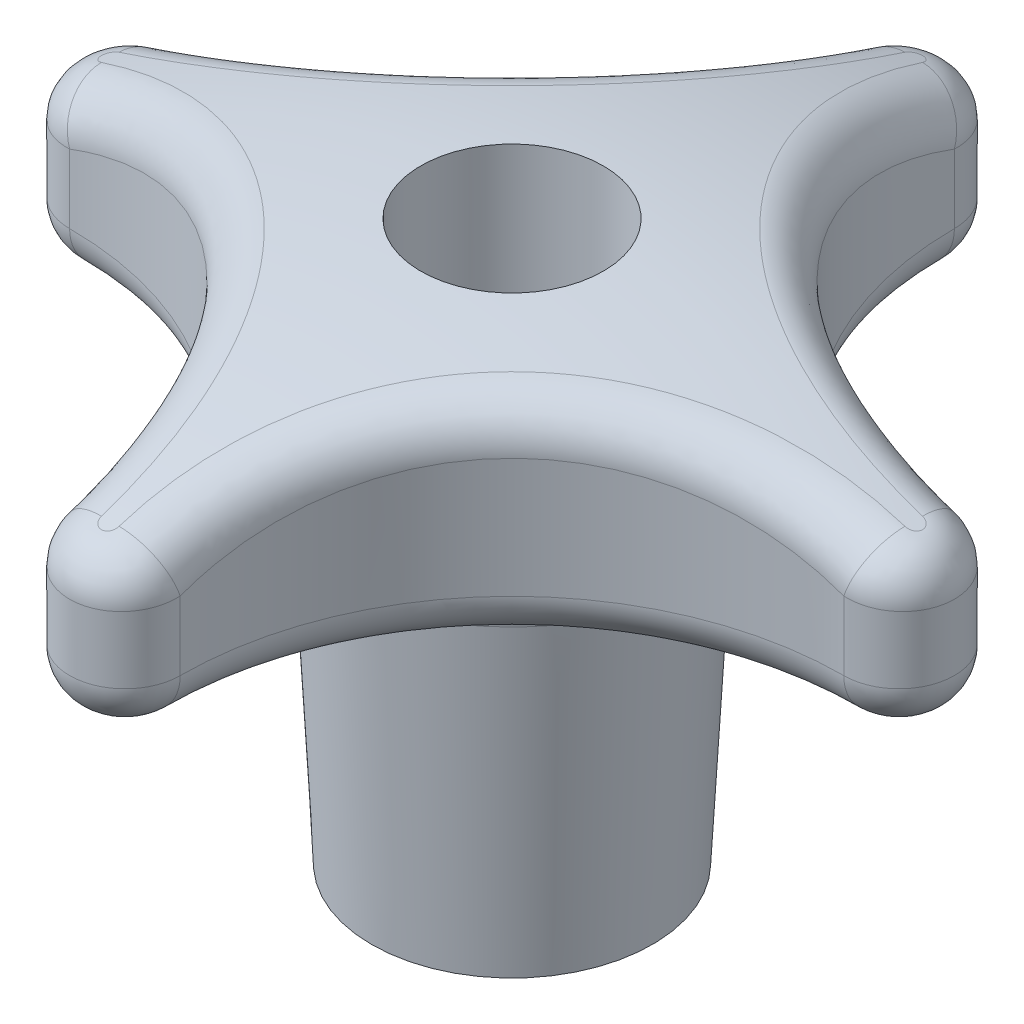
SolidWorks part; units mm, degrees
ref_plane "Front Plane" through (0, 0, 0) normal (0, 0, 1) x (1, 0, 0)
ref_plane "Top Plane" through (0, 0, 0) normal (0, 1, 0) x (1, 0, 0)
ref_plane "Right Plane" through (0, 0, 0) normal (1, 0, 0) x (0, 0, -1)
sketch "Sketch1" plane through (0, 0, 0) normal (0, 1, 0) x (1, 0, 0)
  circle A0 centre (0, 0) radius 10
  dimension "D1" = 20
extrude "Extrude1" add sketch "Sketch1" against normal blind 24
draft "Draft1" type of draft neutral plane draft angle 3 faces to draft 1 parameters "D1"=3
sketch "Sketch2" plane through (0, 0, 0) normal (0, 0, 1) x (1, 0, 0)
  line L0 (0, 0) -> (-31.5, 0)
  line L1 (-31.5, 0) -> (-31.5, 10.4)
  line L2 (0, 0) -> (0, 50000) construction
  line L3 (0, 16) -> (20.2547, 16) construction
  line L4 (0, 0) -> (0, 16)
  arc A0 (0, 16) -> (-31.5, 10.4) centre (0, -75.3937) ccw
revolve "Revolve1" add sketch "Sketch2" angle 360 about L2
sketch "Sketch4" plane through (0, 0, 0) normal (0, 1, 0) x (1, 0, 0)
  line L0 (0, 0) -> (-50000, 0) construction
  line L1 (0, 0) -> (0, 50000) construction
  line L2 (-27.5625, 3.9375) -> (-45.9117, 3.9375) construction
  line L3 (-3.9375, 27.5625) -> (-3.9375, 40.3224) construction
  arc A0 (0, 31.5) -> (-3.9375, 27.5625) centre (0, 27.5625) ccw
  arc A1 (-27.5625, 3.9375) -> (-31.5, 0) centre (-27.5625, 0) ccw
  circle A2 centre (0, 0) radius 31.5 construction
  arc A3 (-27.5625, 3.9375) -> (-3.9375, 27.5625) centre (-27.5625, 27.5625) ccw
  arc A4 (0, 31.5) -> (-31.5, 0) centre (-31.5, 31.5) ccw
  point P9 (0, 31.5)
  point P10 (-31.5, 0)
  point P13 (-3.9375, 27.5625)
  point P14 (-27.5625, 3.9375)
extrude "Extrude3" cut sketch "Sketch4" along normal through all
pattern_circular "CirPattern1" count 4 over 360 about axis through (0, 0, 0) along (0, 1, 0) of "Extrude3"
fillet "Fillet2" radius 3.3333 16 edges at (0, 0, 31.5) (10.8571, 0, 10.8571) (31.5, 0, 0) (10.8571, 0, -10.8571) (0, 0, -31.5) (-10.8571, 0, -10.8571) (-31.5, 0, 0) (-0.0002, 10.4, 31.5) (13.2545, 14.6082, 8.763) (31.5, 10.4, 0.0002) (8.763, 14.6082, -13.2545) (0.0002, 10.4, -31.5) (-13.2545, 14.6082, -8.763) (-31.5, 10.4, 0.0002) (-10.8571, 0, 10.8571) (-8.763, 14.6082, 13.2545)
fillet "Fillet3" radius 1.6667 1 edges at (0, 0, 11.2578)
sketch "Sketch6" [suppressed] plane through (0, -30, 0) normal (0, -1, 0) x (1, 0, 0)
  circle A0 centre (0, 0) radius 8
  dimension "D1" = 8
extrude "Extrude5" [suppressed] cut sketch "Sketch6" against normal blind 18
sketch "Sketch7" [suppressed] plane through (0, 0, 0) normal (0, 0, 1) x (1, 0, 0)
  line L0 (0, 2) -> (8, 2)
  line L1 (8, -30) -> (8, 2) construction
  line L2 (8, 2) -> (0, 6.6188)
  line L3 (0, 6.6188) -> (0, 2)
  line L4 (-8, -30) -> (8, -30) construction
revolve "Cut-Revolve1" [suppressed] cut sketch "Sketch7" angle 360 about L3
sketch "Sketch8" plane through (0, -24, 0) normal (0, -1, 0) x (1, 0, 0)
  circle A0 centre (0, 0) radius 6
  dimension "D1" = 12
extrude "Extrude6" cut sketch "Sketch8" against normal blind 20
sketch "Sketch9" plane through (0, -4, 0) normal (0, -1, 0) x (1, 0, 0)
  circle A0 centre (0, 0) radius 6.5
  dimension "D1" = 13
extrude "Extrude7" cut sketch "Sketch9" against normal through all
sketch "Sketch10" [suppressed] plane through (0, -24, 0) normal (0, -1, 0) x (1, 0, 0)
  circle A0 centre (0, 0) radius 6
extrude "Extrude8" [suppressed] cut sketch "Sketch10" against normal blind 15
sketch "Sketch11" [suppressed] plane through (0, 0, 0) normal (0, 0, 1) x (1, 0, 0)
  line L0 (5.1, 7.0555) -> (5.1, -2)
  line L1 (0, 0) -> (0, -5.4531) construction
  line L2 (5.1, 7.0555) -> (0, 10)
  line L3 (0, 10) -> (0, -2)
  line L4 (-6, -2) -> (6, -2) construction
  line L5 (5.1, -2) -> (0, -2)
revolve "Cut-Revolve2" [suppressed] cut sketch "Sketch11" angle 360 about L3
equation "\"D2@Sketch2\" = \"D1@Sketch2\"*.65"
equation "\"D1@Sketch4\" = (\"D3@Sketch2\"*2)/8"
equation "\"D2@Sketch4\" =( \"D3@Sketch2\"*2)/8"
equation "\"D1@Sketch7\" = \"D1@Extrude5\""
equation "\"D1@Fillet3\" = \"D1@Fillet2\"/2"
equation "\"D2@Sketch11\" = \"D1@Sketch10\""
